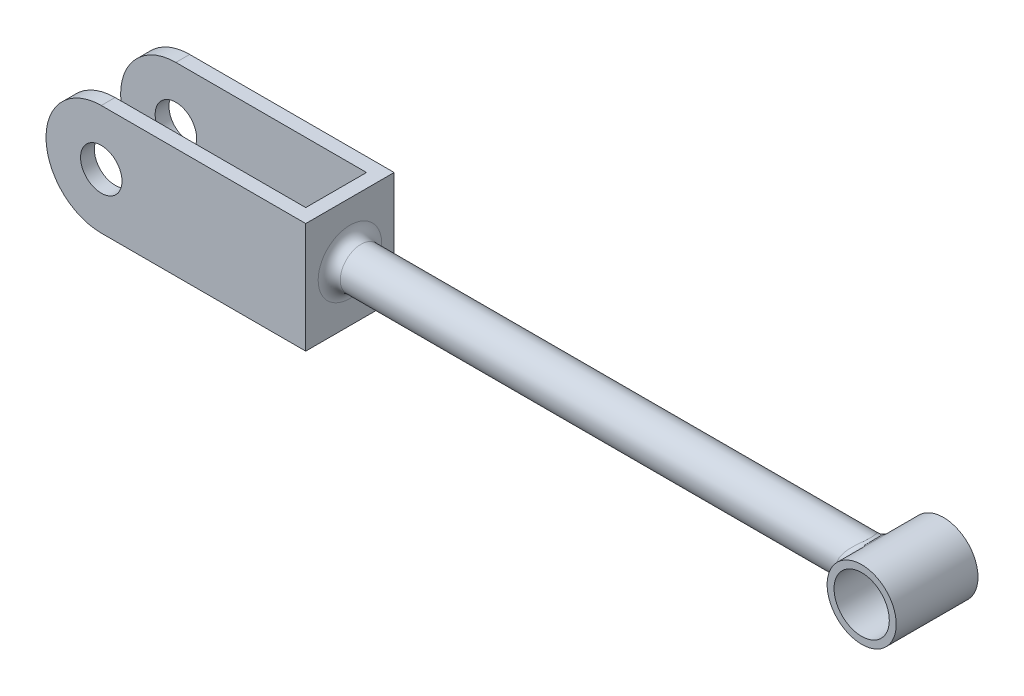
SolidWorks part; units mm, degrees
ref_plane "Front Plane" through (0, 0, 0) normal (0, 0, 1) x (1, 0, 0)
ref_plane "Top Plane" through (0, 0, 0) normal (0, 1, 0) x (1, 0, 0)
ref_plane "Right Plane" through (0, 0, 0) normal (1, 0, 0) x (0, 0, -1)
sketch "Sketch1" plane through (0, 0, 0) normal (0, 0, 1) x (1, 0, 0)
  line L2 (0, 6.35) -> (-23.495, 6.35)
  line L3 (-23.495, -6.35) -> (0, -6.35)
  line L4 (0, -6.35) -> (0, 6.35)
  arc A0 (-23.495, 6.35) -> (-23.495, -6.35) centre (-23.495, 0) ccw
  circle A1 centre (-23.495, 0) radius 2.3813
  dimension "D2" = 6.35
  dimension "D3" = 4.7625
  dimension "D1" = 23.495
extrude "Extrude1" add sketch "Sketch1" along normal mid plane 10.16
sketch "Sketch2" plane through (0, 6.35, 0) normal (0, 1, 0) x (-1, 0, 0)
  line L0 (29.845, -5.08) -> (29.845, 5.08) construction
  line L4 (29.845, -3.4925) -> (29.845, 3.4925)
  line L8 (1.5875, -3.4925) -> (21.9075, -3.4925)
  line L9 (21.9075, -3.4925) -> (21.9075, 3.4925)
  line L10 (21.9075, 3.4925) -> (1.5875, 3.4925)
  line L11 (1.5875, 3.4925) -> (1.5875, -3.4925)
  line L12 (1.5875, -3.4925) -> (29.845, -3.4925)
  line L14 (29.845, 3.4925) -> (1.5875, 3.4925)
  line L15 (1.5875, 3.4925) -> (1.5875, -3.4925)
  dimension "D1" = 1.5875
extrude "Cut-Extrude1" cut sketch "Sketch2" against normal through all
sketch "Sketch3" plane through (0, 0, 0) normal (1, 0, 0) x (0, 0, -1)
  circle A0 centre (0, 0) radius 2.3813
  dimension "D1" = 4.7625
sketch "Sketch4" plane through (0, 0, 0) normal (0, 0, 1) x (1, 0, 0)
  line L0 (0, 0) -> (63.5, 0) construction
  line L1 (0, -2.3813) -> (0, 2.3813) construction
  circle A0 centre (63.5, 0) radius 3.175
  circle A1 centre (63.5, 0) radius 3.9687
  dimension "D2" = 6.35
  dimension "D1" = 63.5
  dimension "D3" = 0.7937
extrude "Extrude3" add sketch "Sketch4" along normal mid plane 9.398
extrude "Extrude4" add sketch "Sketch3" along normal up to next
fillet "Fillet1" radius 1.27 2 edges at (59.5831, 0.6394, -2.2938) (0, 0, 2.3813)
